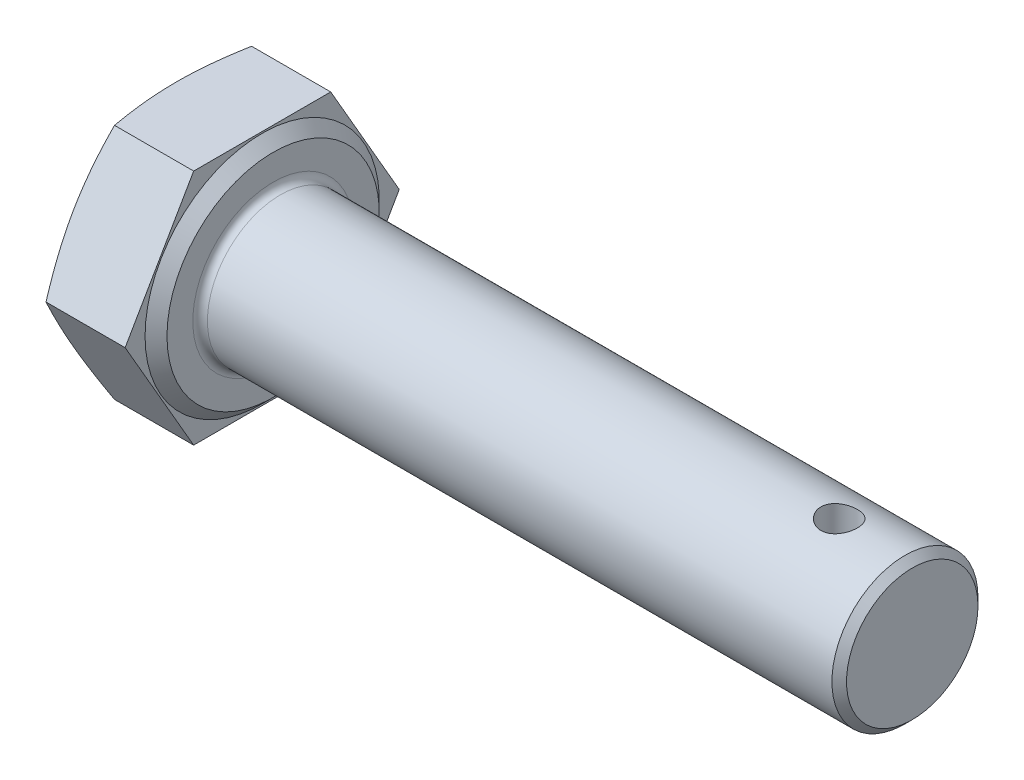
SolidWorks part; units mm, degrees
ref_plane "Front" through (0, 0, 0) normal (0, 0, 1) x (1, 0, 0)
ref_plane "Top" through (0, 0, 0) normal (0, 1, 0) x (1, 0, 0)
ref_plane "Right" through (0, 0, 0) normal (1, 0, 0) x (0, 0, -1)
sketch "Sketch2" plane through (0, 0, 0) normal (1, 0, 0) x (0, 0, -1)
  line L1 (7.5056, 0) -> (3.7528, 6.5)
  line L2 (3.7528, 6.5) -> (-3.7528, 6.5)
  line L3 (-3.7528, 6.5) -> (-7.5056, 0)
  line L4 (-7.5056, 0) -> (-3.7528, -6.5)
  line L5 (-3.7528, -6.5) -> (3.7528, -6.5)
  line L6 (3.7528, -6.5) -> (7.5056, 0)
  circle A0 centre (0, 0) radius 6.5 construction
  dimension "s" = 13
extrude "BaseHead" add sketch "Sketch2" along normal blind 5.3
sketch "Sketch3" plane through (0, 0, 0) normal (0, 1, 0) x (1, 0, 0)
  line L0 (5.3, 7.5056) -> (5.3, 5.815)
  line L2 (5.3, 5.815) -> (4.7, 6.415)
  line L3 (4.7, 6.415) -> (4.7, 7.5056)
  line L5 (4.7, 7.5056) -> (5.3, 7.5056)
  line L6 (-0.9571, 0) -> (7.6478, 0) construction
  line L9 (5.3, 7.5056) -> (0, 7.5056) construction
  dimension "D1" = 45
  dimension "c" = 0.6
  dimension "dw" = 11.63
revolve "BearingFace" cut sketch "Sketch3" angle 360 about L6
sketch "Sketch4" plane through (0, 0, 0) normal (0, 1, 0) x (1, 0, 0)
  line L0 (-0.4935, 0) -> (3.5626, 0) construction
  line L2 (0, 7.5056) -> (0.366, 7.5056)
  line L4 (0.366, 7.5056) -> (0, 6.5)
  line L6 (0, 6.5) -> (0, 7.5056)
  line L7 (4.7, 7.5056) -> (0, 7.5056) construction
  dimension "D1" = 20
  dimension "D2" = 13
revolve "HeadChamfer" cut sketch "Sketch4" angle 360 about L0
sketch "Sketch5" plane through (5.3, 0, 0) normal (1, 0, 0) x (0, 0, -1)
  circle A0 centre (0, 0) radius 4
  dimension "d" = 8
extrude "BaseBody" add sketch "Sketch5" along normal blind 35
chamfer "Chamfer1" distance 0.4 angle 45 1 edges at (40.3, 0, -4)
ref_plane "Plane1" through (23.3, 0, 0) normal (1, 0, 0) x (0, 0, -1)
sketch "Sketch6" plane through (0, 0, 0) normal (0, 1, 0) x (1, 0, 0)
  line L3 (5.3, -5.815) -> (5.3, 5.815) construction
  line L4 (39.9, 0) -> (5.3, 0) construction
  circle A0 centre (36.3, 0) radius 1
  dimension "d1" = 2
  dimension "lh" = 31
extrude "Hole" cut sketch "Sketch6" against normal through all and the other way through all
fillet "HeadFillet" radius 0.4 1 edges at (5.3, 0, -4)
sketch "Sketch7" plane through (0, 0, 0) normal (0, 0, 1) x (1, 0, 0)
  line L0 (39.4, 4.2) -> (39.9, 4.2)
  line L1 (39.9, 4.2) -> (39.9, 4)
  line L2 (39.9, 4) -> (39.65, 3.567)
  line L3 (39.4, 4) -> (39.65, 3.567)
  line L4 (39.4, 4.2) -> (39.4, 4)
  line L5 (6.5265, 0) -> (0, 0) construction
  line L6 (39.4, 4) -> (39.9, 4) construction
  line L7 (39.65, 4) -> (39.65, 3.567) construction
  point P5 (39.65, 4.2)
  dimension "D1" = 0.2
  dimension "D2" = 0.5
revolve "Cut-Revolve10" [suppressed] cut sketch "Sketch7" angle 360 about L5
pattern_linear "LPattern10" [suppressed] count 28 spacing 0.6
equation "\"D2@Sketch4\" = \"s@Sketch2\""
equation "\"b@ThreadCosmetic1\" = \"l@BaseBody\" - \"lg@Plane1\""
equation "\"D1@Chamfer1\" = 0.05 * \"d@Sketch5\""
equation "\"D2@Sketch7\" = (  \"d@Sketch5\" -\"D2@ThreadCosmetic1\" )  / 2"
equation "\"D3@LPattern10\" = \"D2@Sketch7\" * 1.2"
equation "\"D1@LPattern10\" = \"b@ThreadCosmetic1\" / \"D3@LPattern10\""
